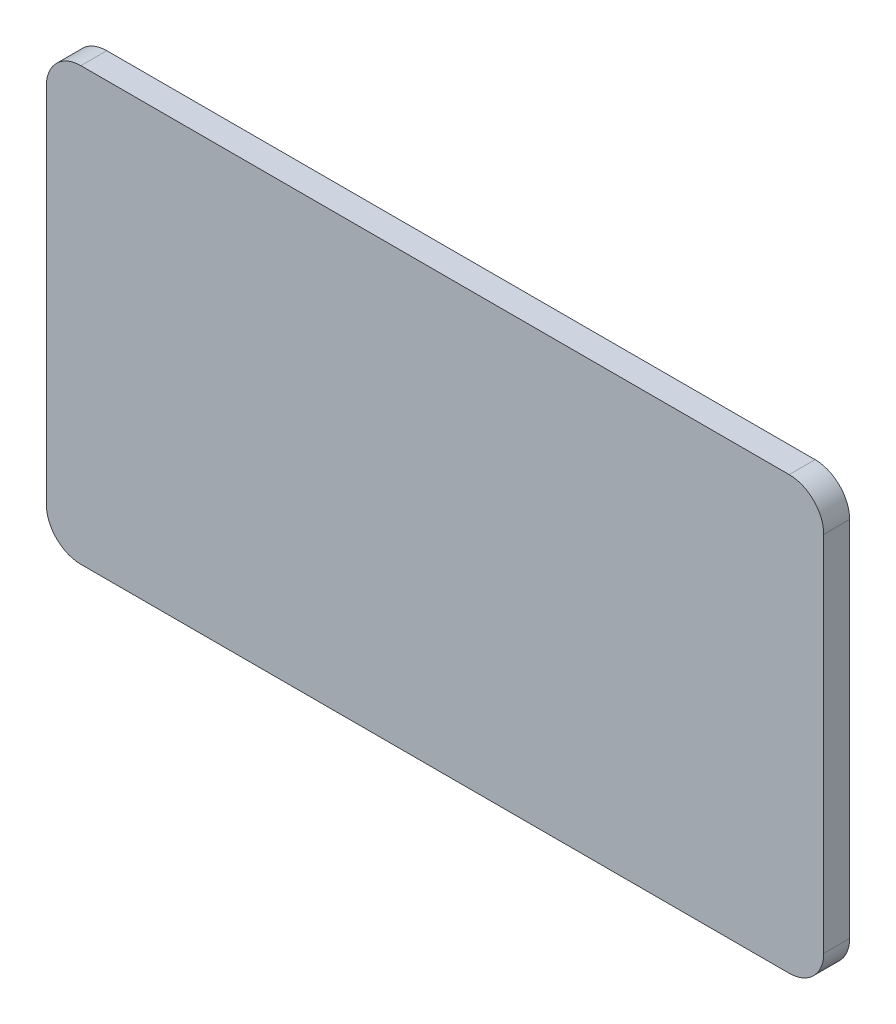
SolidWorks part; units mm, degrees
ref_plane "Front Plane" through (0, 0, 0) normal (0, 0, 1) x (1, 0, 0)
ref_plane "Top Plane" through (0, 0, 0) normal (0, 1, 0) x (1, 0, 0)
ref_plane "Right Plane" through (0, 0, 0) normal (1, 0, 0) x (0, 0, -1)
sketch "Sketch1" plane through (0, 0, 0) normal (0, 0, 1) x (1, 0, 0)
  line L8 (-120.65, -11.43) -> (-120.65, -64.77)
  line L9 (-115.57, -69.85) -> (-11.43, -69.85)
  line L10 (-6.35, -64.77) -> (-6.35, -11.43)
  line L11 (-11.43, -6.35) -> (-115.57, -6.35)
  line L12 (-120.65, -11.43) -> (-120.65, -64.77)
  line L13 (-115.57, -69.85) -> (-11.43, -69.85)
  line L14 (-6.35, -64.77) -> (-6.35, -11.43)
  line L15 (-11.43, -6.35) -> (-115.57, -6.35)
  arc A8 (-115.57, -6.35) -> (-120.65, -11.43) centre (-115.57, -11.43) ccw
  arc A9 (-120.65, -64.77) -> (-115.57, -69.85) centre (-115.57, -64.77) ccw
  arc A10 (-11.43, -69.85) -> (-6.35, -64.77) centre (-11.43, -64.77) ccw
  arc A11 (-6.35, -11.43) -> (-11.43, -6.35) centre (-11.43, -11.43) ccw
  arc A12 (-115.57, -6.35) -> (-120.65, -11.43) centre (-115.57, -11.43) ccw
  arc A13 (-120.65, -64.77) -> (-115.57, -69.85) centre (-115.57, -64.77) ccw
  arc A14 (-11.43, -69.85) -> (-6.35, -64.77) centre (-11.43, -64.77) ccw
  arc A15 (-6.35, -11.43) -> (-11.43, -6.35) centre (-11.43, -11.43) ccw
  dimension "D1" = 1.27
extrude "Extrude1" add sketch "Sketch1" along normal blind 3.81
